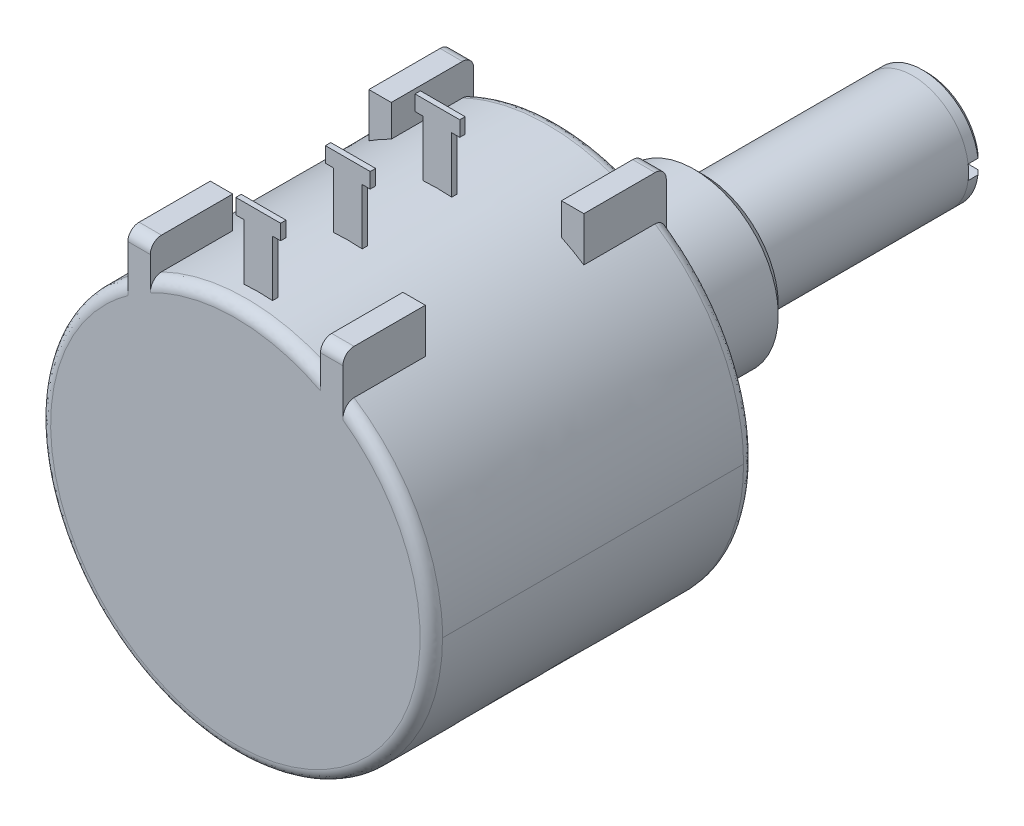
SolidWorks part; units mm, degrees
ref_plane "Piano frontale" through (0, 0, 0) normal (0, 0, 1) x (1, 0, 0)
ref_plane "Piano superiore" through (0, 0, 0) normal (0, 1, 0) x (1, 0, 0)
ref_plane "Piano destro" through (0, 0, 0) normal (1, 0, 0) x (0, 0, -1)
imported_body "Importato3"
sketch "Schizzo1" plane through (0, 10.0099, 0) normal (0, 1, 0) x (-1, 0, 0)
  line L0 (4.826, 0) -> (4.826, 4.6736)
  line L1 (4.826, 4.6736) -> (6.096, 4.6736)
  line L2 (6.096, 4.6736) -> (6.096, 0)
  line L3 (6.096, 0) -> (4.826, 0)
extrude "Estrusione-Estrusione1" add sketch "Schizzo1" along normal blind 1.1026
sketch "Schizzo2" plane through (0, 10.0099, 0) normal (0, 1, 0) x (-1, 0, 0)
  line L0 (6.096, 18.3388) -> (6.096, 13.6652)
  line L1 (6.096, 13.6652) -> (4.826, 13.6652)
  line L2 (4.826, 13.6652) -> (4.826, 18.3388)
  line L3 (4.826, 18.3388) -> (6.096, 18.3388)
extrude "Estrusione-Estrusione2" add sketch "Schizzo2" along normal blind 1.8011
sketch "Schizzo3" plane through (0, 11.1125, 0) normal (0, 1, 0) x (-1, 0, 0)
  line L0 (4.826, 0) -> (4.826, 4.6736)
  line L1 (4.826, 4.6736) -> (6.096, 4.6736)
  line L2 (6.096, 4.6736) -> (6.096, 0)
  line L3 (6.096, 0) -> (4.826, 0)
extrude "Estrusione-Estrusione3" add sketch "Schizzo3" along normal blind 0.6985
sketch "Schizzo4" plane through (0, 10.0099, 0) normal (0, 1, 0) x (-1, 0, 0)
  line L0 (-6.096, 0) -> (-6.096, 4.6736)
  line L1 (-6.096, 4.6736) -> (-4.826, 4.6736)
  line L2 (-4.826, 4.6736) -> (-4.826, 0)
  line L3 (-4.826, 0) -> (-6.096, 0)
extrude "Estrusione-Estrusione4" add sketch "Schizzo4" along normal blind 1.8011
sketch "Schizzo5" plane through (0, 10.0099, 0) normal (0, 1, 0) x (-1, 0, 0)
  line L0 (-4.826, 18.3388) -> (-4.826, 13.6652)
  line L1 (-4.826, 13.6652) -> (-6.096, 13.6652)
  line L2 (-6.096, 13.6652) -> (-6.096, 18.3388)
  line L3 (-6.096, 18.3388) -> (-4.826, 18.3388)
extrude "Estrusione-Estrusione5" add sketch "Schizzo5" along normal blind 1.1026
sketch "Schizzo6" plane through (0, 11.1125, 0) normal (0, 1, 0) x (-1, 0, 0)
  line L0 (-4.826, 18.3388) -> (-4.826, 13.6652)
  line L1 (-4.826, 13.6652) -> (-6.096, 13.6652)
  line L2 (-6.096, 13.6652) -> (-6.096, 18.3388)
  line L3 (-6.096, 18.3388) -> (-4.826, 18.3388)
extrude "Estrusione-Estrusione6" add sketch "Schizzo6" along normal blind 0.6985
ref_plane "Piano1" through (0, 15.113, 0) normal (0, 1, 0) x (1, 0, 0)
sketch "Schizzo7" plane through (0, 15.113, 0) normal (0, 1, 0) x (1, 0, 0)
  line L0 (0.8128, -6.5786) -> (-0.8128, -6.5786)
  line L1 (-0.8128, -6.5786) -> (-0.8128, -6.8834)
  line L2 (-0.8128, -6.8834) -> (0.8128, -6.8834)
  line L3 (0.8128, -6.8834) -> (0.8128, -6.5786)
extrude "Estrusione-Estrusione7" add sketch "Schizzo7" against normal up to next
sketch "Schizzo8" plane through (-0.8128, 0, 0) normal (-1, 0, 0) x (0, 0, 1)
  line L0 (6.8834, 14.2494) -> (6.5786, 14.2494)
  line L1 (6.5786, 14.2494) -> (6.5786, 15.113)
  line L2 (6.5786, 15.113) -> (6.8834, 15.113)
  line L3 (6.8834, 15.113) -> (6.8834, 14.2494)
extrude "Estrusione-Estrusione8" add sketch "Schizzo8" along normal blind 0.4572
sketch "Schizzo9" plane through (0.8128, 0, 0) normal (1, 0, 0) x (0, 0, -1)
  line L0 (-6.8834, 15.113) -> (-6.5786, 15.113)
  line L1 (-6.5786, 15.113) -> (-6.5786, 14.2494)
  line L2 (-6.5786, 14.2494) -> (-6.8834, 14.2494)
  line L3 (-6.8834, 14.2494) -> (-6.8834, 15.113)
extrude "Estrusione-Estrusione9" add sketch "Schizzo9" along normal blind 0.4572
sketch "Schizzo10" plane through (0, 15.113, 0) normal (0, 1, 0) x (1, 0, 0)
  line L0 (0.8128, -11.6586) -> (-0.8128, -11.6586)
  line L1 (-0.8128, -11.6586) -> (-0.8128, -11.9634)
  line L2 (-0.8128, -11.9634) -> (0.8128, -11.9634)
  line L3 (0.8128, -11.9634) -> (0.8128, -11.6586)
extrude "Estrusione-Estrusione10" add sketch "Schizzo10" against normal up to next
sketch "Schizzo11" plane through (-0.8128, 0, 0) normal (-1, 0, 0) x (0, 0, 1)
  line L0 (11.9634, 14.2494) -> (11.6586, 14.2494)
  line L1 (11.6586, 14.2494) -> (11.6586, 15.113)
  line L2 (11.6586, 15.113) -> (11.9634, 15.113)
  line L3 (11.9634, 15.113) -> (11.9634, 14.2494)
extrude "Estrusione-Estrusione11" add sketch "Schizzo11" along normal blind 0.4572
sketch "Schizzo12" plane through (0.8128, 0, 0) normal (1, 0, 0) x (0, 0, -1)
  line L0 (-11.9634, 15.113) -> (-11.6586, 15.113)
  line L1 (-11.6586, 15.113) -> (-11.6586, 14.2494)
  line L2 (-11.6586, 14.2494) -> (-11.9634, 14.2494)
  line L3 (-11.9634, 14.2494) -> (-11.9634, 15.113)
extrude "Estrusione-Estrusione12" add sketch "Schizzo12" along normal blind 0.4572
sketch "Schizzo13" plane through (0, 15.113, 0) normal (0, 1, 0) x (1, 0, 0)
  line L0 (0.8128, -16.7386) -> (-0.8128, -16.7386)
  line L1 (-0.8128, -16.7386) -> (-0.8128, -17.0434)
  line L2 (-0.8128, -17.0434) -> (0.8128, -17.0434)
  line L3 (0.8128, -17.0434) -> (0.8128, -16.7386)
extrude "Estrusione-Estrusione13" add sketch "Schizzo13" against normal up to next
sketch "Schizzo14" plane through (-0.8128, 0, 0) normal (-1, 0, 0) x (0, 0, 1)
  line L0 (17.0434, 14.2494) -> (16.7386, 14.2494)
  line L1 (16.7386, 14.2494) -> (16.7386, 15.113)
  line L2 (16.7386, 15.113) -> (17.0434, 15.113)
  line L3 (17.0434, 15.113) -> (17.0434, 14.2494)
extrude "Estrusione-Estrusione14" add sketch "Schizzo14" along normal blind 0.4572
sketch "Schizzo15" plane through (0.8128, 0, 0) normal (1, 0, 0) x (0, 0, -1)
  line L0 (-17.0434, 15.113) -> (-16.7386, 15.113)
  line L1 (-16.7386, 15.113) -> (-16.7386, 14.2494)
  line L2 (-16.7386, 14.2494) -> (-17.0434, 14.2494)
  line L3 (-17.0434, 14.2494) -> (-17.0434, 15.113)
extrude "Estrusione-Estrusione15" add sketch "Schizzo15" along normal blind 0.4572
sketch "Schizzo16" plane through (0, 0, 0) normal (0, 0, -1) x (-1, 0, 0)
  arc A0 (6.35, 0) -> (-6.35, 0) centre (0, 0) ccw
  arc A1 (-6.35, 0) -> (6.35, 0) centre (0, 0) ccw
extrude "Estrusione-Estrusione16" add sketch "Schizzo16" along normal blind 0.254
sketch "Schizzo17" plane through (0, 0, -0.254) normal (0, 0, -1) x (-1, 0, 0)
  arc A0 (4.7625, 0) -> (-4.7625, 0) centre (0, 0) cw
  arc A1 (-4.7625, 0) -> (4.7625, 0) centre (0, 0) cw
extrude "Estrusione-Estrusione17" add sketch "Schizzo17" along normal blind 7.9375
sketch "Schizzo18" plane through (0, 0, -8.1915) normal (0, 0, -1) x (-1, 0, 0)
  arc A0 (-3.175, 0) -> (3.175, 0) centre (0, 0) cw
  arc A1 (3.175, 0) -> (-3.175, 0) centre (0, 0) cw
extrude "Estrusione-Estrusione18" add sketch "Schizzo18" along normal blind 11.8745
sketch "Schizzo19" plane through (0, 0, -20.066) normal (0, 0, -1) x (-1, 0, 0)
  line L0 (-3.1489, -0.4064) -> (3.1489, -0.4064)
  arc A0 (3.1489, -0.4064) -> (-3.1489, -0.4064) centre (0, 0) cw
extrude "Estrusione-Estrusione19" add sketch "Schizzo19" along normal blind 0.8128
sketch "Schizzo20" plane through (0, 0, -20.066) normal (0, 0, -1) x (-1, 0, 0)
  line L0 (3.1489, 0.4064) -> (-3.1489, 0.4064)
  arc A0 (-3.1489, 0.4064) -> (3.1489, 0.4064) centre (0, 0) cw
extrude "Estrusione-Estrusione20" add sketch "Schizzo20" along normal blind 0.8128
chamfer "Smusso1" distance 0.254 angle 45 2 edges at (0, 3.175, -20.8788) (0, -3.175, -20.8788)
chamfer "Smusso2" distance 0.508 angle 45 1 edges at (4.7625, 0, -8.1915)
fillet "Raccordo1" radius 0.635 6 edges at (1.2406, 11.043, 18.3388) (-1.2406, 11.043, 0) (-5.461, 11.811, 18.3388) (-5.461, 11.811, 0) (5.461, 11.811, 0) (5.461, 11.811, 18.3388)
